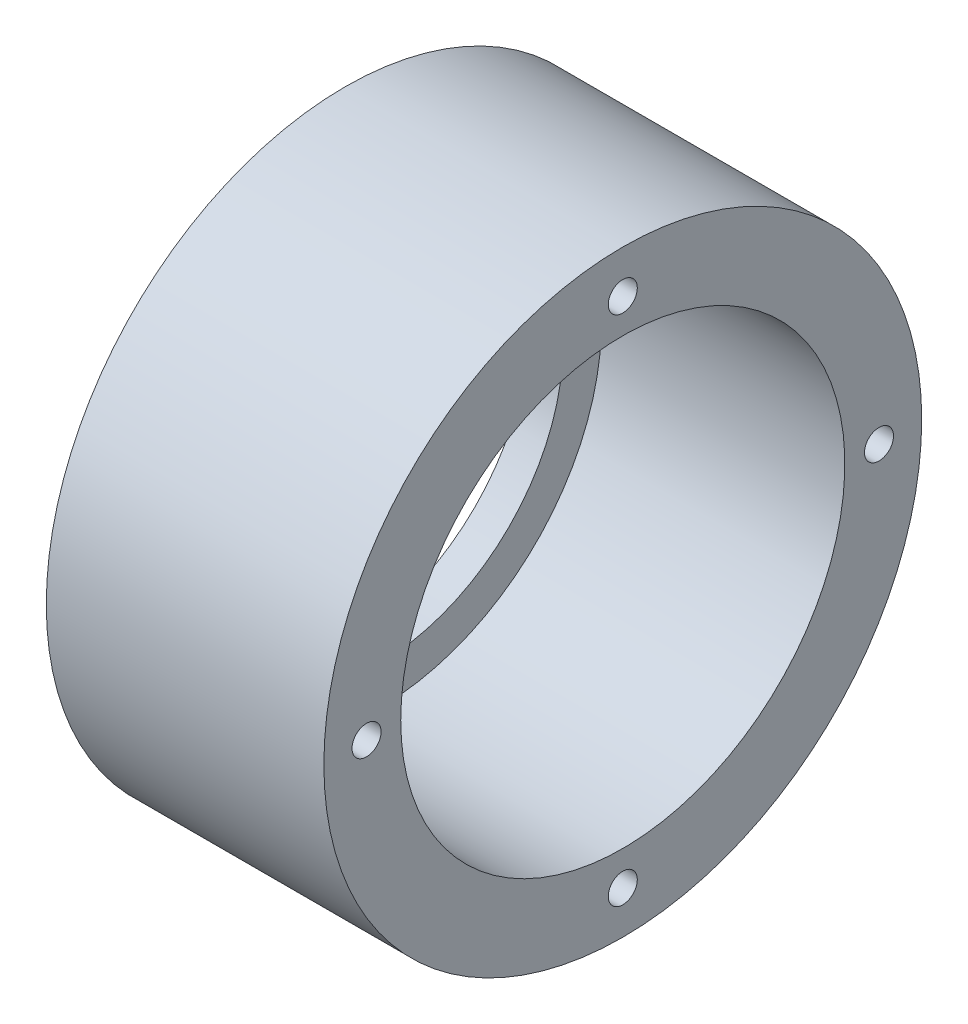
SolidWorks part; units mm, degrees
ref_plane "Front Plane" through (0, 0, 0) normal (0, 0, 1) x (1, 0, 0)
ref_plane "Top Plane" through (0, 0, 0) normal (0, 1, 0) x (1, 0, 0)
ref_plane "Right Plane" through (0, 0, 0) normal (1, 0, 0) x (0, 0, -1)
sketch "Sketch1" plane through (0, 0, 0) normal (0, 0, 1) x (1, 0, 0)
  line L0 (0, 43) -> (0, 70)
  line L1 (0, 70) -> (65, 70)
  line L2 (65, 70) -> (65, 52)
  line L3 (65, 52) -> (8, 52)
  line L4 (8, 52) -> (8, 43)
  line L5 (8, 43) -> (0, 43)
  line L6 (0, 0) -> (65, 0) construction
  point P9 (32.5, 0)
  dimension "D1" = 65
  dimension "D2" = 8
  dimension "D3" = 43
  dimension "D4" = 52
  dimension "D5" = 70
revolve "Revolve1" add sketch "Sketch1" angle 360 about L6
hole_wizard "M8 Tapped Hole1" positions "Sketch3" profile "Sketch5" tap size "M8" standard "DIN"
sketch "Sketch3" plane through (65, 0, 0) normal (1, 0, 0) x (0, 0, -1)
  line L0 (0, 0) -> (0, 60) construction
  point P0 (0, 60)
  dimension "D1" = 60
sketch "Sketch5" plane through (65, 60, 0) normal (0, 1, 0) x (0, 0, -1)
  line L0 (0, 0) -> (0, 24.0429)
  line L1 (0, 24.0429) -> (3.4, 22)
  line L2 (3.4, 22) -> (3.4, 0)
  line L5 (3.4, 0) -> (0, 0)
  line L10 (0, 24.0429) -> (-3.4, 22) construction
  line L11 (0, -6.35) -> (0, 107.95) construction
  dimension "Tap Drill Dia." = 6.8
  dimension "Tap Drill Depth" = 22
  dimension "Drill Angle" = 118
pattern_circular "CirPattern1" count 4 over 360 about axis through (0, 0, 0) along (1, 0, 0) of "M8 Tapped Hole1"
